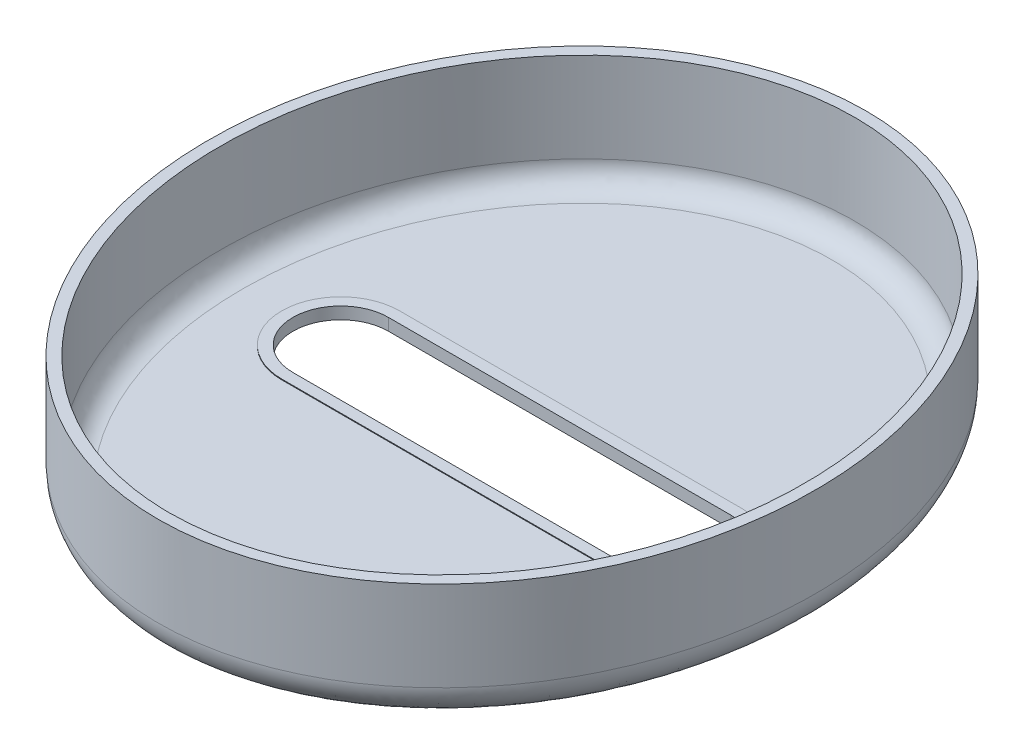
SolidWorks part; units mm, degrees
ref_plane "Front" through (0, 0, 0) normal (0, 0, 1) x (1, 0, 0)
ref_plane "Top" through (0, 0, 0) normal (0, 1, 0) x (1, 0, 0)
ref_plane "Right" through (0, 0, 0) normal (1, 0, 0) x (0, 0, -1)
sketch "Эскиз1" plane through (0, 0, 0) normal (0, 1, 0) x (1, 0, 0)
  line L0 (-35.1514, 0) -> (33.683, 0) construction
  line L1 (0, 38.4548) -> (0, -4.25) construction
  line L3 (-15.25, -4.25) -> (15.25, -4.25)
  line L5 (-15.25, 4.25) -> (15.25, 4.25)
  arc A0 (-15.25, 4.25) -> (-15.25, -4.25) centre (-15.25, 0) ccw
  arc A1 (15.25, 4.25) -> (15.25, -4.25) centre (15.25, 0) cw
  ellipse E0 centre (0, 0) end of major axis (0, 31.5) minor radius 27
  dimension "D1" = 30.5
  dimension "D2" = 8.5
extrude "Бобышка-Вытянуть2" add sketch "Эскиз1" along normal blind 11 contours E0 | L5 A1 L3 A0
shell "Оболочка2" thickness 1
fillet "Скругление1" radius 3 1 edges at (0, 0, -31.5)
sketch "Эскиз6" plane through (0, 0, 5.25) normal (0, 0, 1) x (1, 0, 0)
  line L0 (-20.5843, 1.0686) -> (21.1055, 1.0686)
  line L1 (21.1055, 1.0686) -> (21.1055, 11.3611)
  line L2 (21.1055, 11.3611) -> (-20.5843, 11.3611)
  line L3 (-20.5843, 11.3611) -> (-20.5843, 1.0686)
extrude "Вырез-Вытянуть2" cut sketch "Эскиз6" against normal blind 12
fillet "Скругление2" radius 2 1 edges at (-4.3275, 1, -30.0742)
